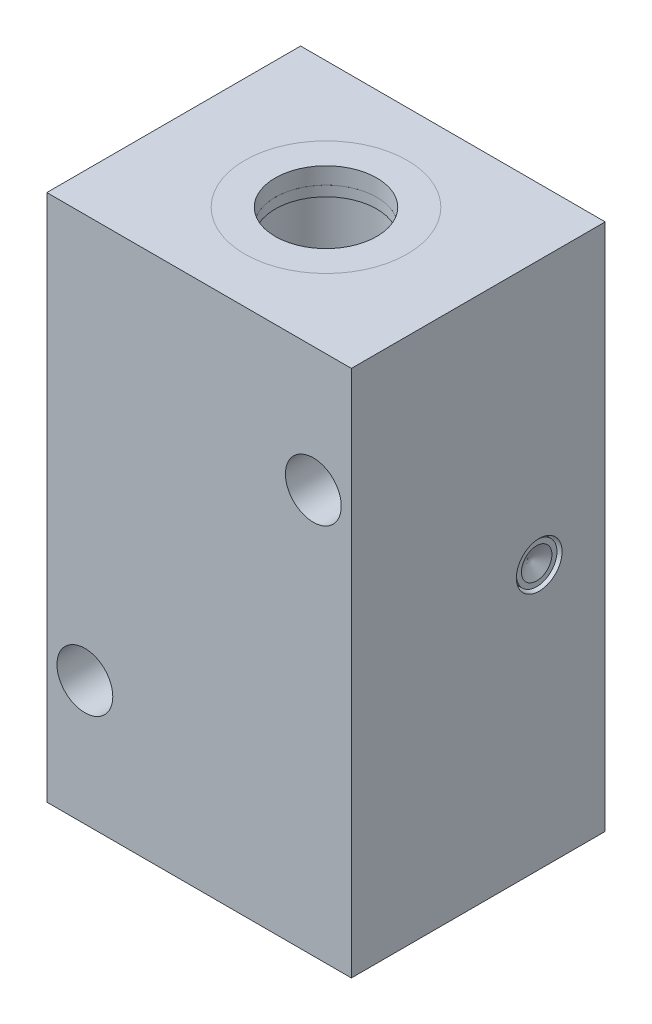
SolidWorks part; units mm, degrees
ref_plane "Plan de face" through (0, 0, 0) normal (0, 0, 1) x (1, 0, 0)
ref_plane "Plan de dessus" through (0, 0, 0) normal (0, 1, 0) x (1, 0, 0)
ref_plane "Plan de droite" through (0, 0, 0) normal (1, 0, 0) x (0, 0, -1)
imported_body " Importée1"
sketch "Esquisse1" plane through (0, 0, -24.2) normal (0, 0, -1) x (-1, 0, 0)
  line L0 (-19, -52) -> (-30, -52)
  line L1 (-30, -52) -> (-30, 52)
  line L2 (-30, 52) -> (-19, 52)
  line L3 (-19, 52) -> (-19, -52)
extrude "Extrusion1" add sketch "Esquisse1" along normal blind 0.8
sketch "Esquisse2" plane through (-29.4, 0, 0) normal (-1, 0, 0) x (0, 0, 1)
  line L0 (-25, 52) -> (-19, 52)
  line L1 (-19, 52) -> (-19, -52)
  line L2 (-19, -52) -> (-25, -52)
  line L3 (-25, -52) -> (-25, 52)
extrude "Extrusion2" add sketch "Esquisse2" along normal blind 0.6
hole_wizard "Perçage1" positions "Esquisse4" profile "Esquisse3" legacy
sketch "Esquisse4" plane through (0, 0, 12) normal (0, 0, 1) x (1, 0, 0)
  point P0 (-22.5, -27.5)
sketch "Esquisse3" plane through (-22.5, -27.5, 12) normal (1, 0, 0) x (0, -1, 0)
  line L0 (0, 0) -> (0, 19.001)
  line L1 (0, 19.001) -> (3.3, 19.001)
  line L2 (3.3, 19.001) -> (3.3, 0)
  line L3 (3.3, 0) -> (0, 0)
  line L4 (0, 110) -> (0, -10) construction
  dimension "Diamètre" = 6.6
  dimension "Profondeur" = 19.001
ref_plane "Plan1" through (0, 46.7, 0) normal (0, 1, 0) x (-1, 0, 0)
sketch "Esquisse5" plane through (0, 46.7, 0) normal (0, 1, 0) x (-1, 0, 0)
  circle A0 centre (0, 0) radius 10.5
extrude "Enlèv. mat.-Extru.1" cut sketch "Esquisse5" against normal blind 41
ref_plane "Plan2" through (0, 41.799, 0) normal (0, 1, 0) x (-1, 0, 0)
ref_plane "Plan3" through (0, -5.7, 0) normal (0, 1, 0) x (-1, 0, 0)
sketch "Esquisse12" plane through (0, -5.7, 0) normal (0, 1, 0) x (-1, 0, 0)
  circle A0 centre (0, 0) radius 10.5
extrude "Enlèv. mat.-Extru.2" cut sketch "Esquisse12" against normal blind 41
ref_plane "Plan4" through (0, -10.601, 0) normal (0, 1, 0) x (-1, 0, 0)
ref_plane "Plan5" through (0, -41.799, 0) normal (0, -1, 0) x (1, 0, 0)
hole_wizard "Perçage2" positions "Esquisse20" profile "Esquisse19" legacy
sketch "Esquisse20" plane through (30, 0, 0) normal (1, 0, 0) x (0, 0, -1)
  point P0 (12, 0)
sketch "Esquisse19" plane through (30, 0, -12) normal (0, 1, 0) x (0, 0, -1)
  line L0 (0, 0) -> (0, 2.5)
  line L1 (0, 2.5) -> (4.5, 2.5)
  line L2 (4.5, 2.5) -> (4.5, 0)
  line L3 (4.5, 0) -> (0, 0)
  line L4 (0, 110) -> (0, -10) construction
  dimension "Diamètre" = 9
  dimension "Profondeur" = 2.5
sketch "Esquisse21" plane through (0, 0, 0) normal (0, 0, 1) x (1, 0, 0)
  line L0 (16, 52) -> (0, 52)
  line L1 (0, 52) -> (0, 46.7)
  line L2 (0, 46.7) -> (10, 46.7)
  line L3 (10, 46.7) -> (10, 48.7)
  line L4 (10, 48.7) -> (16, 48.7)
  line L5 (16, 48.7) -> (16, 52)
  line L6 (0, 52) -> (0, 46.7) construction
revolve "Enlèvement de matière-Révolution1" cut sketch "Esquisse21" angle 360 about L6
ref_plane "Plan6" through (-6.3778, 11.5395, 0) normal (-0.4837, 0.8752, 0) x (-0.8752, -0.4837, 0)
sketch "Esquisse22" plane through (-6.3778, 11.5395, 0) normal (-0.4837, 0.8752, 0) x (-0.8752, -0.4837, 0)
  line L0 (-32.9949, -25) -> (-28.9959, -25)
  line L1 (-28.9959, -25) -> (-29.6929, -24.303)
  line L2 (-29.6929, -24.303) -> (-29.6929, -7.001)
  line L3 (-29.6929, -7.001) -> (-29.6929, 12)
  line L4 (-29.6929, 12) -> (-32.9949, 12)
  line L5 (-32.9949, 12) -> (-32.9949, -25)
  line L6 (-32.9949, 12) -> (-32.9949, -25) construction
revolve "Enlèvement de matière-Révolution2" cut sketch "Esquisse22" angle 360 about L6
ref_plane "Plan7" through (0, 0, -12) normal (0, 0, 1) x (1, 0, 0)
sketch "Esquisse23" plane through (0, 0, -12) normal (0, 0, 1) x (1, 0, 0)
  line L0 (27.5, 4) -> (27.5, 0)
  line L1 (27.5, 0) -> (29.5, 0)
  line L2 (29.5, 0) -> (29.5, 4)
  line L3 (29.5, 4) -> (27.5, 4)
  line L4 (27.5, 0) -> (29.5, 0) construction
revolve "Révolution1" add sketch "Esquisse23" angle 360 about L4
ref_plane "Plan8" through (0, 0, -12) normal (0, 0, -1) x (-1, 0, 0)
sketch "Esquisse24" plane through (0, 0, -12) normal (0, 0, -1) x (-1, 0, 0)
  line L0 (-29.5, 3) -> (-29.5, 0)
  line L1 (-29.5, 0) -> (-27.7679, 0)
  line L2 (-27.7679, 0) -> (-29.5, 3)
  line L3 (-29.5, 0) -> (-27.7678, 0) construction
revolve "Enlèvement de matière-Révolution3" cut sketch "Esquisse24" angle 360 about L3
sketch "Esquisse25" plane through (0, 0, 0) normal (0, 0, 1) x (1, 0, 0)
  line L0 (10, 5.7) -> (0, 5.7)
  line L1 (0, 5.7) -> (0, -5.7)
  line L2 (0, -5.7) -> (10, -5.7)
  line L3 (10, -5.7) -> (10, -3.7)
  line L4 (10, -3.7) -> (16, -3.7)
  line L5 (16, -3.7) -> (16, 3.7)
  line L6 (16, 3.7) -> (10, 3.7)
  line L7 (10, 3.7) -> (10, 5.7)
  line L8 (0, 5.7) -> (0, -5.7) construction
revolve "Enlèvement de matière-Révolution4" cut sketch "Esquisse25" angle 360 about L8
hole_wizard "Perçage3" positions "Esquisse27" profile "Esquisse26" legacy
sketch "Esquisse27" plane through (0, -52, 0) normal (0, -1, 0) x (1, 0, 0)
  point P0 (0, 0)
sketch "Esquisse26" plane through (0, -52, 0) normal (1, 0, 0) x (0, 0, -1)
  line L0 (0, 0) -> (0, 5.3)
  line L1 (0, 5.3) -> (10, 5.3)
  line L2 (10, 5.3) -> (10, 3.3)
  line L3 (10, 3.3) -> (16, 3.3)
  line L4 (16, 3.3) -> (16, 0)
  line L5 (16, 0) -> (0, 0)
  line L6 (0, 110) -> (0, -10) construction
  dimension "Diamètre" = 20
  dimension "Profondeur" = 5.3
  dimension "Diamètre chambrage" = 32
  dimension "Profondeur chambrage" = 3.3
hole_wizard "Trou taraudé M81" positions "Esquisse29" profile "Esquisse28" tap size "M8" standard "ISO"
sketch "Esquisse29" plane through (0, 0, -25) normal (0, 0, -1) x (-1, 0, 0)
  circle A0 centre (-22.5, 27.5) radius 3.302 construction
  circle A1 centre (22.5, -27.5) radius 3.3 construction
  point P0 (-22.5, 27.5)
  point P1 (22.5, -27.5)
sketch "Esquisse28" plane through (22.5, 27.5, -25) normal (1, 0, 0) x (0, 1, 0)
  line L0 (0, 0) -> (0, 23.7929)
  line L1 (0, 23.7929) -> (3.4, 21.75)
  line L2 (3.4, 21.75) -> (3.4, 0)
  line L5 (3.4, 0) -> (0, 0)
  line L10 (0, 23.7929) -> (-3.4, 21.75) construction
  line L11 (0, -6.35) -> (0, 107.95) construction
  dimension "Diamètre du trou pour taraudage" = 6.8
  dimension "Profondeur du trou pour taraudage" = 21.75
  dimension "Angle de pointe" = 118
sketch "Esquisse30" plane through (0, -52, 0) normal (0, -1, 0) x (1, 0, 0)
  line L0 (30, -25) -> (19, -25) construction
  line L1 (-30, 25) -> (-22, 25)
  line L2 (-30, 25) -> (-30, -19)
  line L3 (-19, -25) -> (19, -25)
  line L4 (30, 25) -> (30, 7.8)
  line L5 (-22, 25) -> (22, 25) construction
  line L6 (-29.4, 9.09) -> (-22, 25) construction
  line L7 (19, -25) -> (19, -24.2) construction
  line L8 (19, -24.2) -> (-19, -24.2) construction
  line L9 (-19, -24.2) -> (-19, -25) construction
  line L10 (22, 25) -> (30, 7.8) construction
  line L12 (-29.4, -19) -> (-29.4, 9.09) construction
  line L13 (-30, -19) -> (-29.4, -19) construction
  line L14 (19, -25) -> (19, -24.2)
  line L15 (19, -24.2) -> (-19, -24.2)
  line L16 (-19, -24.2) -> (-19, -25)
  line L17 (22, 25) -> (30, 7.8)
  line L18 (-29.4, 9.09) -> (-22, 25)
  line L19 (-29.4, -19) -> (-29.4, 9.09)
  line L20 (-30, -19) -> (-29.4, -19)
  line L21 (22, 25) -> (30, 25)
extrude "Extrusion3" add sketch "Esquisse30" against normal up to surface (104 mm away)
sketch "Esquisse31" plane through (0, 0, 25) normal (0, 0, 1) x (1, 0, 0)
  line L0 (-22.5, -33) -> (-28.0465, -33) construction
  line L1 (-28.0465, -33) -> (-28.0465, -22) construction
  line L2 (-28.0465, -22) -> (-22.5, -22) construction
  line L3 (-22.5, -33) -> (-28.0465, -33)
  line L4 (-28.0465, -33) -> (-28.0465, -22)
  line L5 (-28.0465, -22) -> (-22.5, -22)
  line L6 (28.0465, 22) -> (22.5, 22) construction
  line L7 (22.5, 33) -> (28.0465, 33) construction
  line L8 (28.0465, 33) -> (28.0465, 22) construction
  line L9 (28.0465, 22) -> (22.5, 22)
  line L10 (22.5, 33) -> (28.0465, 33)
  line L11 (28.0465, 33) -> (28.0465, 22)
  arc A0 (-22.5, -33) -> (-22, -32.9772) centre (-22.5, -27.5) ccw construction
  arc A1 (-22, -22.0228) -> (-22.5, -22) centre (-22.5, -27.5) ccw construction
  arc A2 (-22, -32.9772) -> (-22, -22.0228) centre (-22.5, -27.5) ccw construction
  arc A3 (-22.5, -33) -> (-22, -32.9772) centre (-22.5, -27.5) ccw
  arc A4 (-22, -22.0228) -> (-22.5, -22) centre (-22.5, -27.5) ccw
  arc A5 (-22, -32.9772) -> (-22, -22.0228) centre (-22.5, -27.5) ccw
  arc A6 (22, 22.0228) -> (22.5, 22) centre (22.5, 27.5) ccw construction
  arc A7 (22, 32.9772) -> (22, 22.0228) centre (22.5, 27.5) ccw construction
  arc A8 (22.5, 33) -> (22, 32.9772) centre (22.5, 27.5) ccw construction
  arc A9 (22, 22.0228) -> (22.5, 22) centre (22.5, 27.5) ccw
  arc A10 (22, 32.9772) -> (22, 22.0228) centre (22.5, 27.5) ccw
  arc A11 (22.5, 33) -> (22, 32.9772) centre (22.5, 27.5) ccw
extrude "Extrusion5" add sketch "Esquisse31" against normal up to surface (13 mm away)
sketch "Esquisse32" plane through (0, 0, 25) normal (0, 0, 1) x (1, 0, 0)
  circle A0 centre (22.5, 27.5) radius 5.5
  circle A1 centre (-22.5, -27.5) radius 5.5
  dimension "D1" = 11
extrude "Enlèv. mat.-Extru.3" cut sketch "Esquisse32" against normal blind 9
sketch "Esquisse33" plane through (0, 48.7, 0) normal (0, 1, 0) x (1, 0, 0)
  circle A0 centre (0, 0) radius 10
  circle A1 centre (0, 0) radius 16
  circle A2 centre (0, 0) radius 10 construction
  circle A3 centre (0, 0) radius 16 construction
extrude "Extrusion6" add sketch "Esquisse33" along normal up to surface (3.3 mm away) separate body
sketch "Esquisse34" plane through (0, -48.7, 0) normal (0, -1, 0) x (1, 0, 0)
  circle A0 centre (0, 0) radius 10
  circle A1 centre (0, 0) radius 16
  circle A2 centre (0, 0) radius 10 construction
  circle A3 centre (0, 0) radius 16 construction
extrude "Extrusion7" add sketch "Esquisse34" along normal up to surface (3.3 mm away) separate body
sketch "Esquisse35" plane through (0, 0, 12) normal (0, 0, -1) x (-1, 0, 0)
  circle A0 centre (22.5, -27.5) radius 3.3
  circle A1 centre (22.5, -27.5) radius 3.3 construction
  circle A2 centre (-22.5, 27.5) radius 3.302
  circle A3 centre (-22.5, 27.5) radius 3.302 construction
extrude "Enlèv. mat.-Extru.4" cut sketch "Esquisse35" against normal through all
